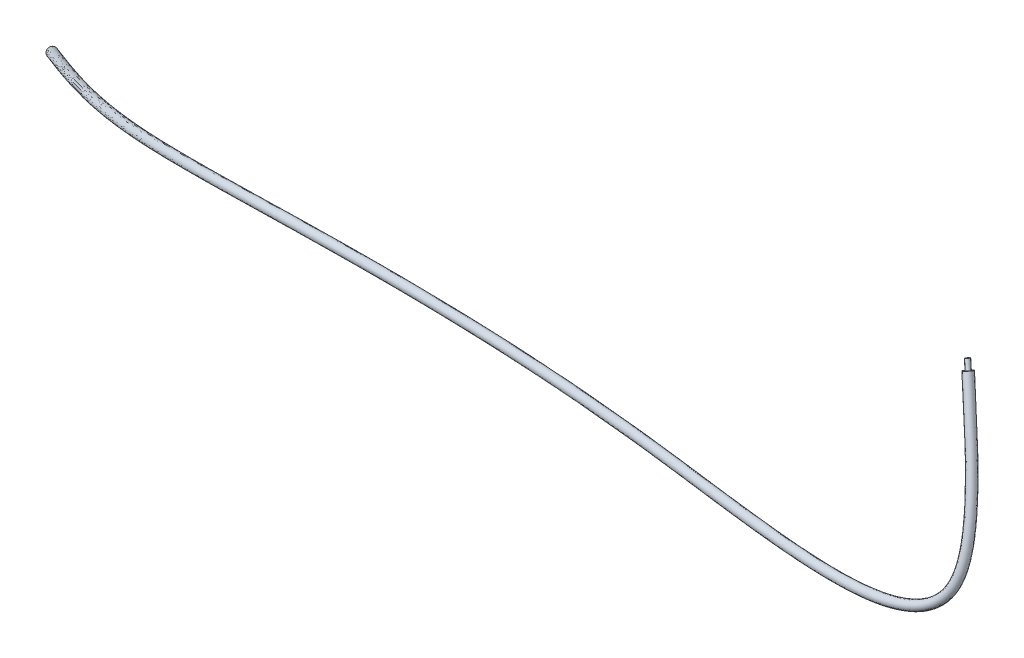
SolidWorks part; units mm, degrees
ref_plane "Plan de face" through (0, 0, 0) normal (0, 0, 1) x (1, 0, 0)
ref_plane "Plan de dessus" through (0, 0, 0) normal (0, 1, 0) x (1, 0, 0)
ref_plane "Plan de droite" through (0, 0, 0) normal (1, 0, 0) x (0, 0, -1)
sketch3d "Esquisse3D1"
  spline S0 degree 3 poles (-42.9771, -26.5304, -21.7317) (-34.8968, -21.9196, -15.7998) (-12.2129, -8.9756, 0.8529) (23.8079, -14.8509, -9.9579) (77.4322, -22.3385, -5.3898) (69.605, -4.4661, -11.815) (66.9619, 1.5691, -13.9847) knots 0 0 0 0 0.225057 0.631804 0.875666 1 1 1 1
ref_plane "Plan2" through (66.9619, 1.5691, -13.9847) normal (-0.381, 0.87, -0.3128) x (-0.9246, -0.3586, 0.1289)
sketch "Esquisse2" plane through (66.9619, 1.5691, -13.9847) normal (-0.381, 0.87, -0.3128) x (-0.9246, -0.3586, 0.1289)
  circle A0 centre (0, 0) radius 0.5
  dimension "D1" = 1
sweep "Balayage4" add profiles "Esquisse2" path "Esquisse3D1"
sketch "Esquisse4" plane through (7.5351, -17.2055, 6.1854) normal (-0.381, 0.87, -0.3128) x (-0.9246, -0.3586, 0.1289)
  circle A2 centre (-64.2757, -12.6293) radius 0.25
  circle A3 centre (-64.2757, -12.6293) radius 0.25
  dimension "D1" = 0.25
extrude "Extrusion1" add sketch "Esquisse4" along normal blind 1
sketch "Esquisse5" plane through (-39.7253, -22.6682, -29.1632) normal (-0.7323, -0.4179, -0.5376) x (-0.467, -0.2665, 0.8432)
  circle A2 centre (8.8136, -1.7429) radius 0.25
  circle A3 centre (8.8136, -1.7429) radius 0.25
  dimension "D1" = 0.25
extrude "Extrusion2" add sketch "Esquisse5" along normal blind 1
